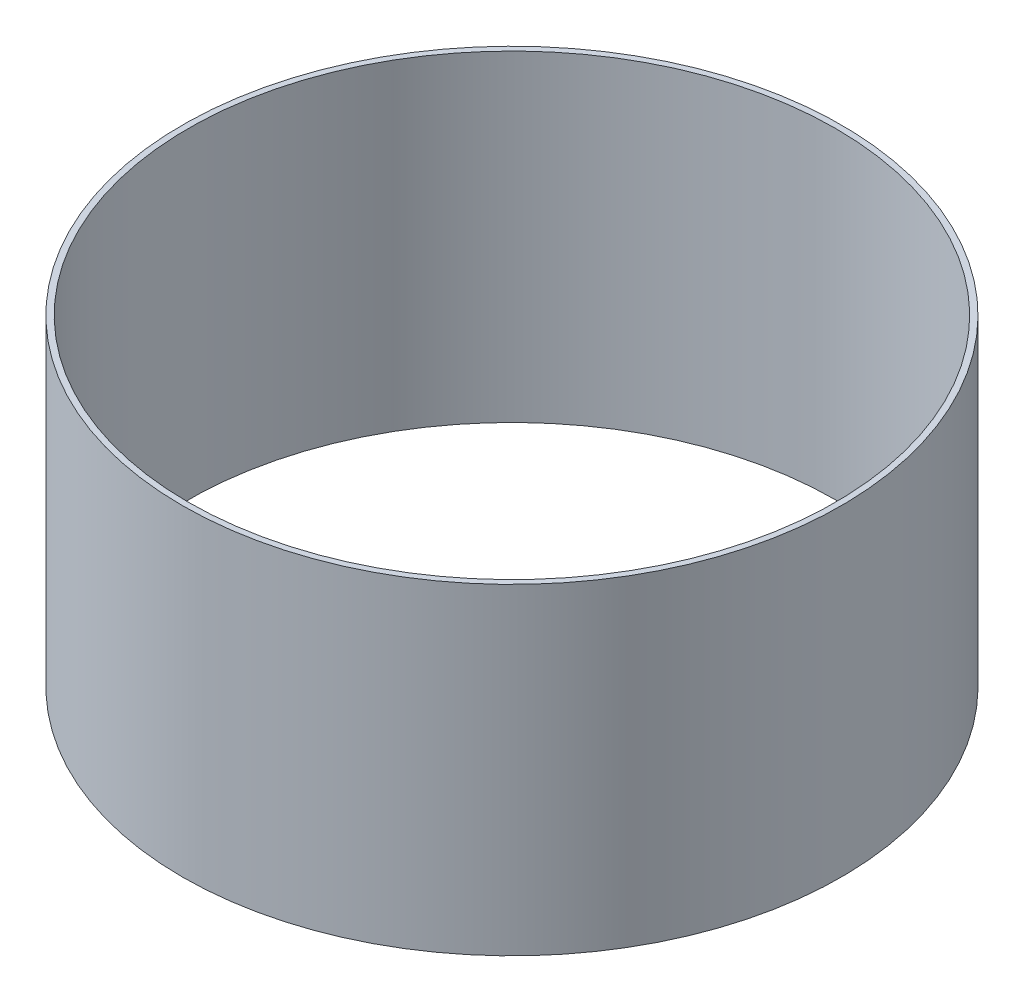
SolidWorks part; units mm, degrees
ref_plane "Face" through (0, 0, 0) normal (0, 0, 1) x (1, 0, 0)
ref_plane "Dessus" through (0, 0, 0) normal (0, 1, 0) x (1, 0, 0)
ref_plane "Droite" through (0, 0, 0) normal (1, 0, 0) x (0, 0, -1)
sketch "Esquisse1" plane through (0, 0, 0) normal (0, 0, 1) x (1, 0, 0)
  line L0 (0, 0) -> (0, 12) construction
  line L1 (0, 12) -> (0, 706)
  line L2 (0, 706) -> (0, 718) construction
  dimension "D1" = 718
  dimension "D2" = 12
other "Tubes ronds - asme - b 36.10 m–1996 Ø1422 X 12,7 (56\" X 0,5)(1)"
ref_plane "Plan1" through (0, 12, 0) normal (0, 1, 0) x (-1, 0, 0)
sketch "Esquisse11" plane through (0, 12, 0) normal (0, 1, 0) x (-1, 0, 0)
  circle A0 centre (0, 0) radius 711
  circle A1 centre (0, 0) radius 698.3
  point P4 (0, 0)
  dimension "Dext" = 1422
  dimension "e" = 12.7
